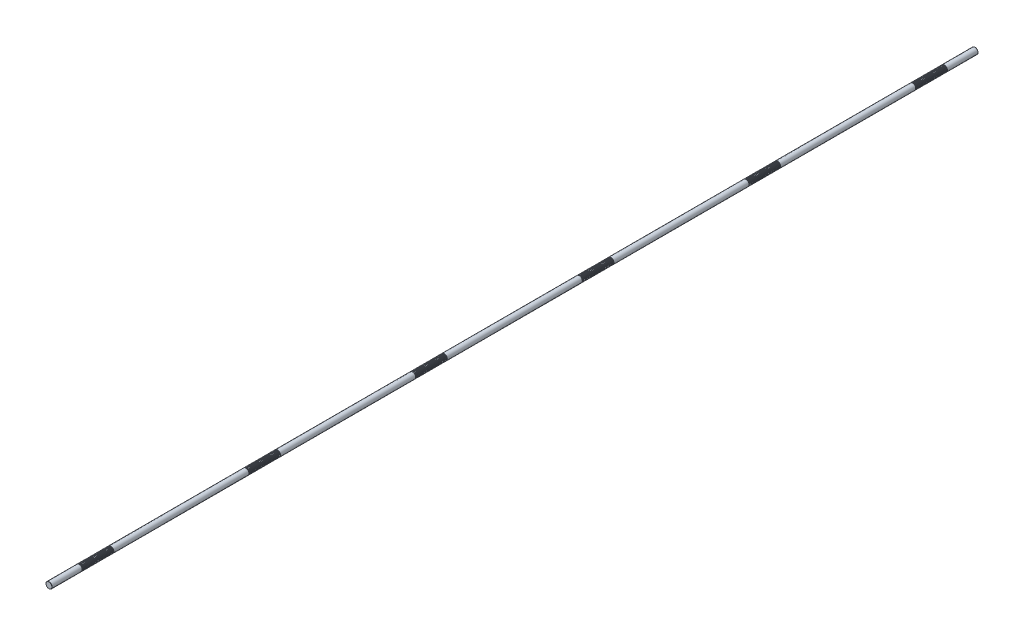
SolidWorks part; units mm, degrees
ref_plane "Front Plane" through (0, 0, 0) normal (0, 0, 1) x (1, 0, 0)
ref_plane "Top Plane" through (0, 0, 0) normal (0, 1, 0) x (1, 0, 0)
ref_plane "Right Plane" through (0, 0, 0) normal (1, 0, 0) x (0, 0, -1)
sketch "Sketch1" plane through (0, 0, 0) normal (0, 0, 1) x (1, 0, 0)
  circle A0 centre (0, 0) radius 10
  dimension "D1" = 20
extrude "Boss-Extrude1" add sketch "Sketch1" along normal mid plane 3000
chamfer "Chamfer1" distance 0.5 angle 45 2 edges at (10, 0, -1500) (10, 0, 1500)
sketch "Sketch2" plane through (0, 0, 0) normal (1, 0, 0) x (0, 0, -1)
  line L0 (1400.3014, 10) -> (1397.6986, 10)
  line L1 (1499.5, 10) -> (-1499.5, 10) construction
  line L2 (1397.6986, 10) -> (1398.3014, 7.75)
  line L3 (1398.3014, 7.75) -> (1399.6986, 7.75)
  line L4 (1399.6986, 7.75) -> (1400.3014, 10)
  line L5 (1500, -9.5) -> (1500, 9.5) construction
  point P4 (1399, 10)
  point P7 (1399, 7.75)
  point P8 (1400, 8.875)
  point P9 (1398, 8.875)
  dimension "D1" = 2
  dimension "D2" = 100
  dimension "D3" = 2.25
  dimension "D4" = 30
revolve "Cut-Revolve1" cut sketch "Sketch2" angle 360 about axis through (0, 0, 1500) along (0, 0, -1)
pattern_linear "LPattern1" count 26 spacing 4 along (0, 0, 1) of "Cut-Revolve1"
pattern_linear "LPattern2" count 6 spacing 540 along (0, 0, 1) of "Cut-Revolve1", "LPattern1"
